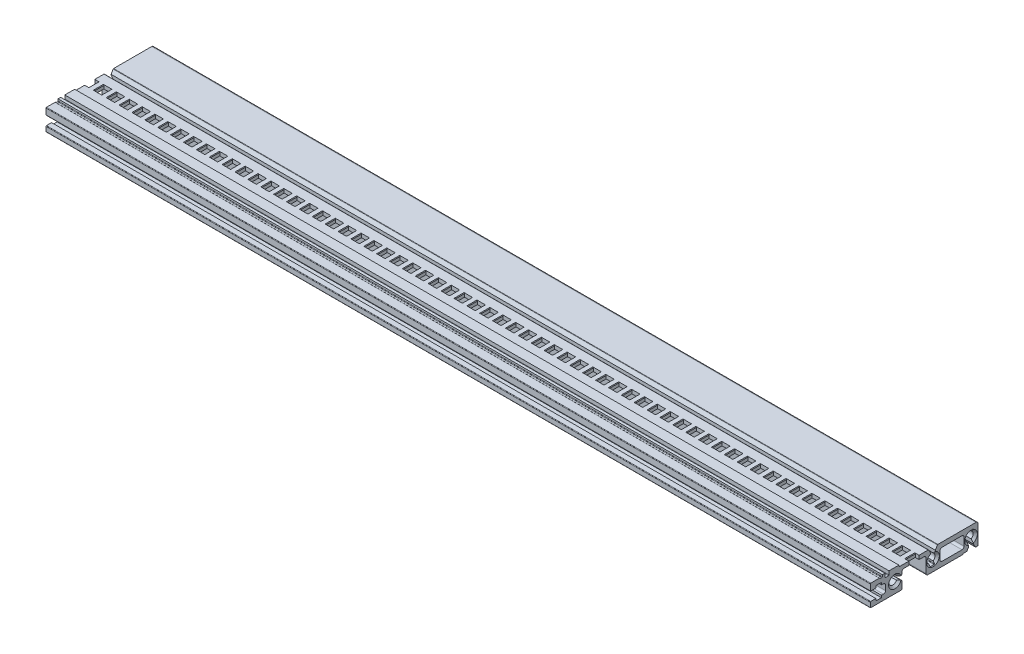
SolidWorks part; units mm, degrees
other "34566584"
ref_plane "前视基准面" through (0, 0, 0) normal (0, 0, 1) x (1, 0, 0)
ref_plane "上视基准面" through (0, 0, 0) normal (0, 1, 0) x (1, 0, 0)
ref_plane "右视基准面" through (0, 0, 0) normal (1, 0, 0) x (0, 0, -1)
imported_body "输入1"
sketch "草图1" plane through (0, 0, 0) normal (0, 1, 0) x (1, 0, 0)
  line L0 (-215.9, 9.4065) -> (-215.9, 24.45) construction
  line L1 (215.9, 41.3252) -> (109.22, 41.3252)
  line L2 (215.9, 41.3252) -> (215.9, -32.8369)
  line L3 (215.9, -32.8369) -> (109.22, -32.8369)
  line L4 (109.22, 41.3252) -> (109.22, -32.8369)
  line L5 (215.9, 24.45) -> (215.9, 9.4065) construction
  dimension "D1" = 325.12
extrude "切除-拉伸1" cut sketch "草图1" against normal mid plane 40
sketch "草图2" plane through (109.22, 0, 0) normal (1, 0, 0) x (0, 0, -1)
  circle A0 centre (-7.5, -4.2) radius 1.65
  circle A1 centre (7.5, -4.2) radius 1.65
  circle A2 centre (22.5, -4.2) radius 1.65
  dimension "D1" = 3.3
extrude "切除-拉伸2" cut sketch "草图2" against normal blind 15.02
chamfer "倒角1" distance 0.85 angle 45 4 edges at (109.22, -4.2, -24.15) (109.22, -4.2, -20.85) (109.22, -4.2, -9.15) (109.22, -4.2, 9.15)
